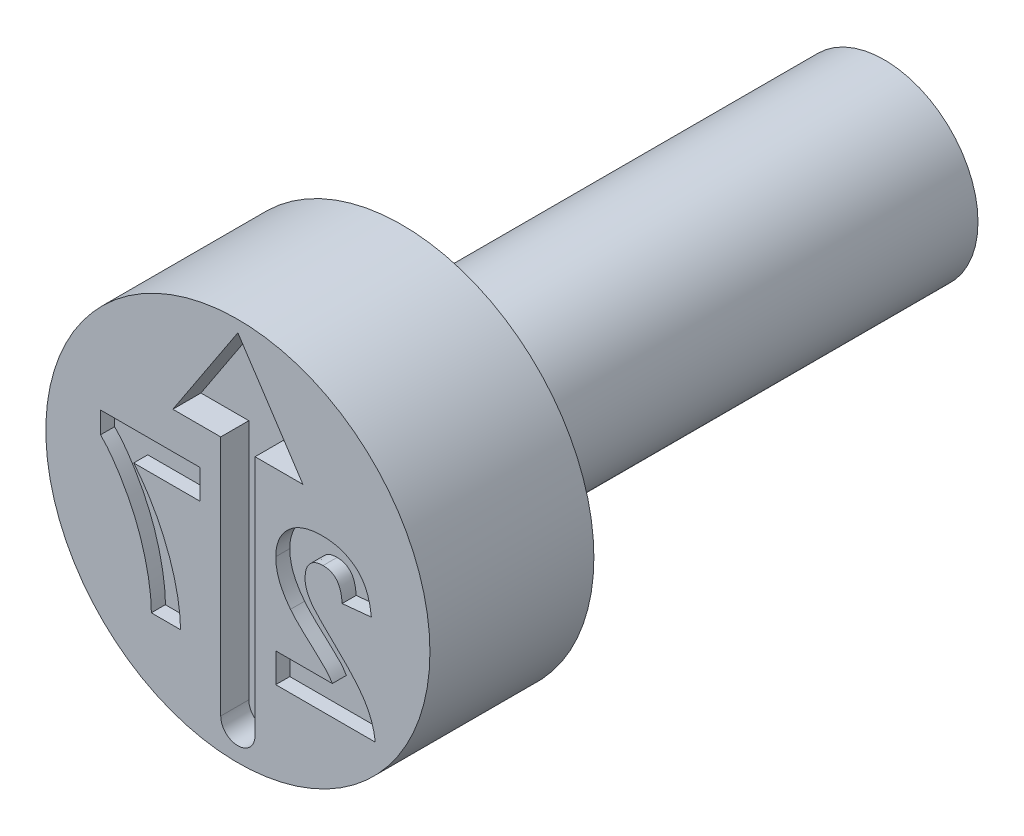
SolidWorks part; units mm, degrees
ref_plane "Front Plane" through (0, 0, 0) normal (0, 0, 1) x (1, 0, 0)
ref_plane "Top Plane" through (0, 0, 0) normal (0, 1, 0) x (1, 0, 0)
ref_plane "Right Plane" through (0, 0, 0) normal (1, 0, 0) x (0, 0, -1)
sketch "Sketch2" plane through (0, 0, 0) normal (1, 0, 0) x (0, 0, -1)
  line L0 (0.4039, 0) -> (50000.4039, 0) construction
  line L6 (0, 4.1) -> (0, 0)
  line L7 (3.5, 4.1) -> (0, 4.1)
  line L8 (3.5, 2) -> (3.5, 4.1)
  line L9 (13.8, 2) -> (3.5, 2)
  line L10 (13.8, 0) -> (13.8, 2)
  line L11 (0, 0) -> (13.8, 0)
  dimension "D1" = 8.2
  dimension "D2" = 4
  dimension "D3" = 13.8
  dimension "D4" = 3.5
revolve "Revolve1" add sketch "Sketch2" angle 360 about L0
sketch "Sketch3" plane through (0, 0, 0) normal (0, 0, 1) x (1, 0, 0)
  line L0 (0, 0) -> (0, 192375) construction
  line L1 (0.3664, 1.7436) -> (0.3664, -3.4169)
  line L2 (1.3888, 1.7436) -> (0.3664, 1.7436)
  line L3 (0, 3.8516) -> (1.3888, 1.7436)
  line L15 (0, 3.8516) -> (-1.3888, 1.7436)
  line L16 (-1.3888, 1.7436) -> (-0.3664, 1.7436)
  line L17 (-0.3664, 1.7436) -> (-0.3664, -3.4169)
  arc A2 (-0.3664, -3.4169) -> (0.3664, -3.4169) centre (0, -3.4169) ccw
extrude "Cut-Extrude4" cut sketch "Sketch3" against normal blind 0.6
sketch "Sketch4" plane through (0, 0, 0) normal (0, 0, 1) x (1, 0, 0)
  text T0 "2  7" font "Arial" height 3.25
  dimension "D1" = 2.25
  dimension "D2" = 3.1
extrude "Cut-Extrude5" cut sketch "Sketch4" against normal blind 0.3
